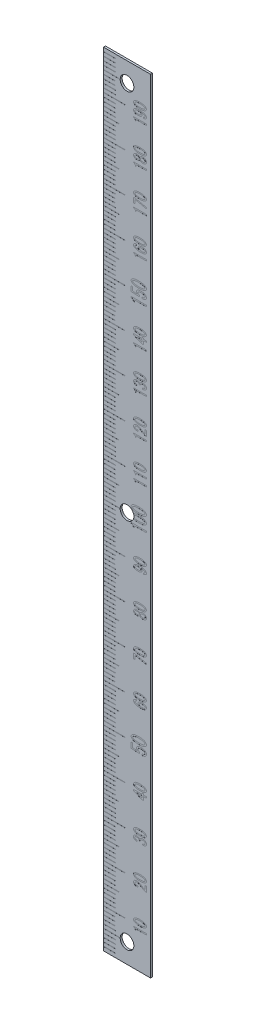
SolidWorks part; units mm, degrees
ref_plane "Front" through (0, 0, 0) normal (0, 0, 1) x (1, 0, 0)
ref_plane "Top" through (0, 0, 0) normal (0, 1, 0) x (1, 0, 0)
ref_plane "Right" through (0, 0, 0) normal (1, 0, 0) x (0, 0, -1)
sketch "Sketch1" plane through (0, 0, 0) normal (0, 0, 1) x (1, 0, 0)
  line L1 (0, 0) -> (0, 200)
  line L2 (0, 0) -> (12, 0)
  line L3 (12, 0) -> (12, 200)
  line L4 (0, 200) -> (12, 200)
  dimension "D1" = 200
  dimension "D2" = 12
extrude "Extrude1" add sketch "Sketch1" along normal blind 0.5
sketch "Sketch2" plane through (0, 0, 0.5) normal (0, 0, 1) x (1, 0, 0)
  line L0 (0, 200) -> (0, 0) construction
  line L1 (0, 0) -> (12, 0) construction
  line L2 (12, 200) -> (0, 200) construction
  circle A0 centre (6, 5) radius 1.75
  circle A1 centre (6, 195) radius 1.75
  circle A4 centre (6, 100) radius 1.75
  dimension "D1" = 6
  dimension "D2" = 6
  dimension "D3" = 5
  dimension "D4" = 5
  dimension "D5" = 3.5
  dimension "D6" = 3.5
  dimension "D8" = 2
extrude "Extrude2" cut sketch "Sketch2" against normal through all and the other way through all
sketch "Sketch3" plane through (0, 0, 0.5) normal (0, 0, 1) x (1, 0, 0)
  line L0 (7.5, 187.4) -> (11, 187.4) construction
  line L1 (7.5, 137.4) -> (11, 137.4) construction
  line L2 (7.5, 137.4) -> (7.5, 140.9) construction
  line L3 (7.5, 140.9) -> (11, 140.9) construction
  line L4 (11, 137.4) -> (11, 140.9) construction
  line L6 (11, 127.4) -> (11, 130.9) construction
  line L7 (11, 117.4) -> (11, 120.9) construction
  line L8 (11, 107.4) -> (11, 110.9) construction
  line L9 (11, 97.2) -> (11, 102.8) construction
  line L10 (11, 88.25) -> (11, 91.75) construction
  line L11 (11, 78.25) -> (11, 81.75) construction
  line L12 (11, 68.25) -> (11, 71.75) construction
  line L13 (11, 58.25) -> (11, 61.75) construction
  line L14 (11, 48) -> (11, 52) construction
  line L15 (11, 38.25) -> (11, 43.5) construction
  line L16 (11, 110) -> (-4.9003, 110) construction
  line L17 (11, 50) -> (-4.9003, 50) construction
  line L18 (11, 28.25) -> (11, 33.5) construction
  line L19 (11, 18.25) -> (11, 23.5) construction
  line L20 (11, 8.25) -> (11, 13.5) construction
  line L21 (11, 100) -> (-4.9003, 100) construction
  line L22 (11, 120) -> (-4.9003, 120) construction
  line L23 (11, 130) -> (-4.9003, 130) construction
  line L24 (11, 140) -> (-4.9003, 140) construction
  line L25 (7.5, 187.4) -> (7.5, 190.9) construction
  line L26 (7.5, 190.9) -> (11, 190.9) construction
  line L27 (11, 187.4) -> (11, 190.9) construction
  line L28 (11, 177.4) -> (11, 180.9) construction
  line L29 (11, 167.4) -> (11, 170.9) construction
  line L30 (11, 157.4) -> (11, 160.9) construction
  line L31 (11, 147.2) -> (11, 152.8) construction
  line L32 (11, 160) -> (-4.9003, 160) construction
  line L33 (11, 150) -> (-4.9003, 150) construction
  line L34 (11, 170) -> (-4.9003, 170) construction
  line L35 (11, 180) -> (-4.9003, 180) construction
  line L36 (11, 190) -> (-4.9003, 190) construction
  line L37 (11, 40) -> (-4.9003, 40) construction
  line L38 (11, 30) -> (-4.9003, 30) construction
  line L39 (11, 20) -> (-4.9003, 20) construction
  line L40 (11, 10) -> (-4.9003, 10) construction
  line L41 (12, 0) -> (12, 200) construction
  text T0 "140" font "ＭＳ ゴシック" height in points 11
  text T1 "130" font "ＭＳ ゴシック" height in points 11
  text T2 "120" font "ＭＳ ゴシック" height in points 11
  text T3 "110" font "ＭＳ ゴシック" height in points 11
  text T4 "100" font "ＭＳ ゴシック" height in points 13
  text T5 "90" font "ＭＳ ゴシック" height in points 11
  text T6 "80" font "ＭＳ ゴシック" height in points 11
  text T7 "70" font "ＭＳ ゴシック" height in points 11
  text T8 "60" font "ＭＳ ゴシック" height in points 11
  text T9 "50" font "ＭＳ ゴシック" height in points 13
  text T10 "40" font "ＭＳ ゴシック" height in points 11
  text T11 "30" font "ＭＳ ゴシック" height in points 11
  text T12 "20" font "ＭＳ ゴシック" height in points 11
  text T13 "10" font "ＭＳ ゴシック" height in points 11
  text T14 "150" font "ＭＳ ゴシック" height in points 13
  text T15 "160" font "ＭＳ ゴシック" height in points 11
  text T16 "170" font "ＭＳ ゴシック" height in points 11
  text T17 "180" font "ＭＳ ゴシック" height in points 11
  text T18 "190" font "ＭＳ ゴシック" height in points 11
  point P19 (11, 100)
  dimension "D1" = 3.5
  dimension "D2" = 2.6
  dimension "D3" = 1
  dimension "D4" = 3.5
  dimension "D8" = 4
  dimension "D9" = 50
  dimension "D10" = 2
  dimension "D11" = 5.6
  dimension "D12" = 2.6
  dimension "D5" = 3.5
  dimension "D13" = 2.6
  dimension "D14" = 2.6
  dimension "D15" = 2
  dimension "D16" = 1.75
  dimension "D17" = 1.75
  dimension "D18" = 1.75
  dimension "D19" = 1.75
  dimension "D6" = 5
  dimension "D7" = 5
extrude "Extrude3" cut sketch "Sketch3" against normal blind 0.01
sketch "Sketch4" plane through (0, 0, 0.5) normal (0, 0, 1) x (1, 0, 0)
  line L5 (12, 200) -> (0, 200) construction
  line L806 (6, 200) -> (6, 0) construction
  line L807 (0, 0) -> (12, 0) construction
  line L808 (3, 1.05) -> (3, 0.95)
  line L809 (0, 0.95) -> (3, 0.95)
  line L810 (0, 1.05) -> (3, 1.05)
  line L811 (0, 1.05) -> (0, 0.95)
  line L812 (3, 2.05) -> (3, 1.95)
  line L813 (0, 1.95) -> (3, 1.95)
  line L814 (0, 2.05) -> (3, 2.05)
  line L815 (0, 2.05) -> (0, 1.95)
  line L816 (3, 3.05) -> (3, 2.95)
  line L817 (0, 2.95) -> (3, 2.95)
  line L818 (0, 3.05) -> (3, 3.05)
  line L819 (0, 3.05) -> (0, 2.95)
  line L820 (3, 4.05) -> (3, 3.95)
  line L821 (0, 3.95) -> (3, 3.95)
  line L822 (0, 4.05) -> (3, 4.05)
  line L823 (0, 4.05) -> (0, 3.95)
  line L824 (3, 6.05) -> (3, 5.95)
  line L825 (0, 5.95) -> (3, 5.95)
  line L826 (0, 6.05) -> (3, 6.05)
  line L827 (0, 6.05) -> (0, 5.95)
  line L828 (3, 7.05) -> (3, 6.95)
  line L829 (0, 6.95) -> (3, 6.95)
  line L830 (0, 7.05) -> (3, 7.05)
  line L831 (0, 7.05) -> (0, 6.95)
  line L832 (3, 8.05) -> (3, 7.95)
  line L833 (0, 7.95) -> (3, 7.95)
  line L834 (0, 8.05) -> (3, 8.05)
  line L835 (3, 9.05) -> (3, 8.95)
  line L836 (0, 8.95) -> (3, 8.95)
  line L837 (0, 9.05) -> (0, 8.95)
  line L838 (0, 9.05) -> (3, 9.05)
  line L839 (4, 4.95) -> (4, 5.05)
  line L840 (0, 5.05) -> (4, 5.05)
  line L841 (0, 4.95) -> (0, 5.05)
  line L842 (0, 4.95) -> (4, 4.95)
  line L843 (0, 8.05) -> (0, 7.95)
  line L844 (0, 9.95) -> (0, 10.05)
  line L845 (5.5, 9.95) -> (0, 9.95)
  line L846 (5.5, 10.05) -> (5.5, 9.95)
  line L847 (0, 10.05) -> (5.5, 10.05)
  line L848 (3, 11.05) -> (3, 10.95)
  line L849 (0, 10.95) -> (3, 10.95)
  line L850 (0, 11.05) -> (3, 11.05)
  line L851 (0, 11.05) -> (0, 10.95)
  line L852 (3, 12.05) -> (3, 11.95)
  line L853 (0, 11.95) -> (3, 11.95)
  line L854 (0, 12.05) -> (3, 12.05)
  line L855 (0, 12.05) -> (0, 11.95)
  line L856 (3, 13.05) -> (3, 12.95)
  line L857 (0, 12.95) -> (3, 12.95)
  line L858 (0, 13.05) -> (3, 13.05)
  line L859 (0, 13.05) -> (0, 12.95)
  line L860 (3, 14.05) -> (3, 13.95)
  line L861 (0, 13.95) -> (3, 13.95)
  line L862 (0, 14.05) -> (3, 14.05)
  line L863 (0, 14.05) -> (0, 13.95)
  line L864 (3, 16.05) -> (3, 15.95)
  line L865 (0, 15.95) -> (3, 15.95)
  line L866 (0, 16.05) -> (3, 16.05)
  line L867 (0, 16.05) -> (0, 15.95)
  line L868 (3, 17.05) -> (3, 16.95)
  line L869 (0, 16.95) -> (3, 16.95)
  line L870 (0, 17.05) -> (3, 17.05)
  line L871 (0, 17.05) -> (0, 16.95)
  line L872 (3, 18.05) -> (3, 17.95)
  line L873 (0, 17.95) -> (3, 17.95)
  line L874 (0, 18.05) -> (3, 18.05)
  line L875 (3, 19.05) -> (3, 18.95)
  line L876 (0, 18.95) -> (3, 18.95)
  line L877 (0, 19.05) -> (0, 18.95)
  line L878 (0, 19.05) -> (3, 19.05)
  line L879 (4, 14.95) -> (4, 15.05)
  line L880 (0, 15.05) -> (4, 15.05)
  line L881 (0, 14.95) -> (0, 15.05)
  line L882 (0, 14.95) -> (4, 14.95)
  line L883 (0, 18.05) -> (0, 17.95)
  line L884 (0, 19.95) -> (0, 20.05)
  line L885 (5.5, 19.95) -> (0, 19.95)
  line L886 (5.5, 20.05) -> (5.5, 19.95)
  line L887 (0, 20.05) -> (5.5, 20.05)
  line L888 (3, 21.05) -> (3, 20.95)
  line L889 (0, 20.95) -> (3, 20.95)
  line L890 (0, 21.05) -> (3, 21.05)
  line L891 (0, 21.05) -> (0, 20.95)
  line L892 (3, 22.05) -> (3, 21.95)
  line L893 (0, 21.95) -> (3, 21.95)
  line L894 (0, 22.05) -> (3, 22.05)
  line L895 (0, 22.05) -> (0, 21.95)
  line L896 (3, 23.05) -> (3, 22.95)
  line L897 (0, 22.95) -> (3, 22.95)
  line L898 (0, 23.05) -> (3, 23.05)
  line L899 (0, 23.05) -> (0, 22.95)
  line L900 (3, 24.05) -> (3, 23.95)
  line L901 (0, 23.95) -> (3, 23.95)
  line L902 (0, 24.05) -> (3, 24.05)
  line L903 (0, 24.05) -> (0, 23.95)
  line L904 (3, 26.05) -> (3, 25.95)
  line L905 (0, 25.95) -> (3, 25.95)
  line L906 (0, 26.05) -> (3, 26.05)
  line L907 (0, 26.05) -> (0, 25.95)
  line L908 (3, 27.05) -> (3, 26.95)
  line L909 (0, 26.95) -> (3, 26.95)
  line L910 (0, 27.05) -> (3, 27.05)
  line L911 (0, 27.05) -> (0, 26.95)
  line L912 (3, 28.05) -> (3, 27.95)
  line L913 (0, 27.95) -> (3, 27.95)
  line L914 (0, 28.05) -> (3, 28.05)
  line L915 (3, 29.05) -> (3, 28.95)
  line L916 (0, 28.95) -> (3, 28.95)
  line L917 (0, 29.05) -> (0, 28.95)
  line L918 (0, 29.05) -> (3, 29.05)
  line L919 (4, 24.95) -> (4, 25.05)
  line L920 (0, 25.05) -> (4, 25.05)
  line L921 (0, 24.95) -> (0, 25.05)
  line L922 (0, 24.95) -> (4, 24.95)
  line L923 (0, 28.05) -> (0, 27.95)
  line L924 (0, 29.95) -> (0, 30.05)
  line L925 (5.5, 29.95) -> (0, 29.95)
  line L926 (5.5, 30.05) -> (5.5, 29.95)
  line L927 (0, 30.05) -> (5.5, 30.05)
  line L928 (3, 31.05) -> (3, 30.95)
  line L929 (0, 30.95) -> (3, 30.95)
  line L930 (0, 31.05) -> (3, 31.05)
  line L931 (0, 31.05) -> (0, 30.95)
  line L932 (3, 32.05) -> (3, 31.95)
  line L933 (0, 31.95) -> (3, 31.95)
  line L934 (0, 32.05) -> (3, 32.05)
  line L935 (0, 32.05) -> (0, 31.95)
  line L936 (3, 33.05) -> (3, 32.95)
  line L937 (0, 32.95) -> (3, 32.95)
  line L938 (0, 33.05) -> (3, 33.05)
  line L939 (0, 33.05) -> (0, 32.95)
  line L940 (3, 34.05) -> (3, 33.95)
  line L941 (0, 33.95) -> (3, 33.95)
  line L942 (0, 34.05) -> (3, 34.05)
  line L943 (0, 34.05) -> (0, 33.95)
  line L944 (3, 36.05) -> (3, 35.95)
  line L945 (0, 35.95) -> (3, 35.95)
  line L946 (0, 36.05) -> (3, 36.05)
  line L947 (0, 36.05) -> (0, 35.95)
  line L948 (3, 37.05) -> (3, 36.95)
  line L949 (0, 36.95) -> (3, 36.95)
  line L950 (0, 37.05) -> (3, 37.05)
  line L951 (0, 37.05) -> (0, 36.95)
  line L952 (3, 38.05) -> (3, 37.95)
  line L953 (0, 37.95) -> (3, 37.95)
  line L954 (0, 38.05) -> (3, 38.05)
  line L955 (3, 39.05) -> (3, 38.95)
  line L956 (0, 38.95) -> (3, 38.95)
  line L957 (0, 39.05) -> (0, 38.95)
  line L958 (0, 39.05) -> (3, 39.05)
  line L959 (4, 34.95) -> (4, 35.05)
  line L960 (0, 35.05) -> (4, 35.05)
  line L961 (0, 34.95) -> (0, 35.05)
  line L962 (0, 34.95) -> (4, 34.95)
  line L963 (0, 38.05) -> (0, 37.95)
  line L964 (0, 39.95) -> (0, 40.05)
  line L965 (5.5, 39.95) -> (0, 39.95)
  line L966 (5.5, 40.05) -> (5.5, 39.95)
  line L967 (0, 40.05) -> (5.5, 40.05)
  line L968 (3, 41.05) -> (3, 40.95)
  line L969 (0, 40.95) -> (3, 40.95)
  line L970 (0, 41.05) -> (3, 41.05)
  line L971 (0, 41.05) -> (0, 40.95)
  line L972 (3, 42.05) -> (3, 41.95)
  line L973 (0, 41.95) -> (3, 41.95)
  line L974 (0, 42.05) -> (3, 42.05)
  line L975 (0, 42.05) -> (0, 41.95)
  line L976 (3, 43.05) -> (3, 42.95)
  line L977 (0, 42.95) -> (3, 42.95)
  line L978 (0, 43.05) -> (3, 43.05)
  line L979 (0, 43.05) -> (0, 42.95)
  line L980 (3, 44.05) -> (3, 43.95)
  line L981 (0, 43.95) -> (3, 43.95)
  line L982 (0, 44.05) -> (3, 44.05)
  line L983 (0, 44.05) -> (0, 43.95)
  line L984 (3, 46.05) -> (3, 45.95)
  line L985 (0, 45.95) -> (3, 45.95)
  line L986 (0, 46.05) -> (3, 46.05)
  line L987 (0, 46.05) -> (0, 45.95)
  line L988 (3, 47.05) -> (3, 46.95)
  line L989 (0, 46.95) -> (3, 46.95)
  line L990 (0, 47.05) -> (3, 47.05)
  line L991 (0, 47.05) -> (0, 46.95)
  line L992 (3, 48.05) -> (3, 47.95)
  line L993 (0, 47.95) -> (3, 47.95)
  line L994 (0, 48.05) -> (3, 48.05)
  line L995 (3, 49.05) -> (3, 48.95)
  line L996 (0, 48.95) -> (3, 48.95)
  line L997 (0, 49.05) -> (0, 48.95)
  line L998 (0, 49.05) -> (3, 49.05)
  line L999 (4, 44.95) -> (4, 45.05)
  line L1000 (0, 45.05) -> (4, 45.05)
  line L1001 (0, 44.95) -> (0, 45.05)
  line L1002 (0, 44.95) -> (4, 44.95)
  line L1003 (0, 48.05) -> (0, 47.95)
  line L1004 (0, 49.95) -> (0, 50.05)
  line L1005 (5.5, 49.95) -> (0, 49.95)
  line L1006 (5.5, 50.05) -> (5.5, 49.95)
  line L1007 (0, 50.05) -> (5.5, 50.05)
  line L1008 (3, 51.05) -> (3, 50.95)
  line L1009 (0, 50.95) -> (3, 50.95)
  line L1010 (0, 51.05) -> (3, 51.05)
  line L1011 (0, 51.05) -> (0, 50.95)
  line L1012 (3, 52.05) -> (3, 51.95)
  line L1013 (0, 51.95) -> (3, 51.95)
  line L1014 (0, 52.05) -> (3, 52.05)
  line L1015 (0, 52.05) -> (0, 51.95)
  line L1016 (3, 53.05) -> (3, 52.95)
  line L1017 (0, 52.95) -> (3, 52.95)
  line L1018 (0, 53.05) -> (3, 53.05)
  line L1019 (0, 53.05) -> (0, 52.95)
  line L1020 (3, 54.05) -> (3, 53.95)
  line L1021 (0, 53.95) -> (3, 53.95)
  line L1022 (0, 54.05) -> (3, 54.05)
  line L1023 (0, 54.05) -> (0, 53.95)
  line L1024 (3, 56.05) -> (3, 55.95)
  line L1025 (0, 55.95) -> (3, 55.95)
  line L1026 (0, 56.05) -> (3, 56.05)
  line L1027 (0, 56.05) -> (0, 55.95)
  line L1028 (3, 57.05) -> (3, 56.95)
  line L1029 (0, 56.95) -> (3, 56.95)
  line L1030 (0, 57.05) -> (3, 57.05)
  line L1031 (0, 57.05) -> (0, 56.95)
  line L1032 (3, 58.05) -> (3, 57.95)
  line L1033 (0, 57.95) -> (3, 57.95)
  line L1034 (0, 58.05) -> (3, 58.05)
  line L1035 (3, 59.05) -> (3, 58.95)
  line L1036 (0, 58.95) -> (3, 58.95)
  line L1037 (0, 59.05) -> (0, 58.95)
  line L1038 (0, 59.05) -> (3, 59.05)
  line L1039 (4, 54.95) -> (4, 55.05)
  line L1040 (0, 55.05) -> (4, 55.05)
  line L1041 (0, 54.95) -> (0, 55.05)
  line L1042 (0, 54.95) -> (4, 54.95)
  line L1043 (0, 58.05) -> (0, 57.95)
  line L1044 (0, 59.95) -> (0, 60.05)
  line L1045 (5.5, 59.95) -> (0, 59.95)
  line L1046 (5.5, 60.05) -> (5.5, 59.95)
  line L1047 (0, 60.05) -> (5.5, 60.05)
  line L1048 (3, 61.05) -> (3, 60.95)
  line L1049 (0, 60.95) -> (3, 60.95)
  line L1050 (0, 61.05) -> (3, 61.05)
  line L1051 (0, 61.05) -> (0, 60.95)
  line L1052 (3, 62.05) -> (3, 61.95)
  line L1053 (0, 61.95) -> (3, 61.95)
  line L1054 (0, 62.05) -> (3, 62.05)
  line L1055 (0, 62.05) -> (0, 61.95)
  line L1056 (3, 63.05) -> (3, 62.95)
  line L1057 (0, 62.95) -> (3, 62.95)
  line L1058 (0, 63.05) -> (3, 63.05)
  line L1059 (0, 63.05) -> (0, 62.95)
  line L1060 (3, 64.05) -> (3, 63.95)
  line L1061 (0, 63.95) -> (3, 63.95)
  line L1062 (0, 64.05) -> (3, 64.05)
  line L1063 (0, 64.05) -> (0, 63.95)
  line L1064 (3, 66.05) -> (3, 65.95)
  line L1065 (0, 65.95) -> (3, 65.95)
  line L1066 (0, 66.05) -> (3, 66.05)
  line L1067 (0, 66.05) -> (0, 65.95)
  line L1068 (3, 67.05) -> (3, 66.95)
  line L1069 (0, 66.95) -> (3, 66.95)
  line L1070 (0, 67.05) -> (3, 67.05)
  line L1071 (0, 67.05) -> (0, 66.95)
  line L1072 (3, 68.05) -> (3, 67.95)
  line L1073 (0, 67.95) -> (3, 67.95)
  line L1074 (0, 68.05) -> (3, 68.05)
  line L1075 (3, 69.05) -> (3, 68.95)
  line L1076 (0, 68.95) -> (3, 68.95)
  line L1077 (0, 69.05) -> (0, 68.95)
  line L1078 (0, 69.05) -> (3, 69.05)
  line L1079 (4, 64.95) -> (4, 65.05)
  line L1080 (0, 65.05) -> (4, 65.05)
  line L1081 (0, 64.95) -> (0, 65.05)
  line L1082 (0, 64.95) -> (4, 64.95)
  line L1083 (0, 68.05) -> (0, 67.95)
  line L1084 (0, 69.95) -> (0, 70.05)
  line L1085 (5.5, 69.95) -> (0, 69.95)
  line L1086 (5.5, 70.05) -> (5.5, 69.95)
  line L1087 (0, 70.05) -> (5.5, 70.05)
  line L1088 (3, 71.05) -> (3, 70.95)
  line L1089 (0, 70.95) -> (3, 70.95)
  line L1090 (0, 71.05) -> (3, 71.05)
  line L1091 (0, 71.05) -> (0, 70.95)
  line L1092 (3, 72.05) -> (3, 71.95)
  line L1093 (0, 71.95) -> (3, 71.95)
  line L1094 (0, 72.05) -> (3, 72.05)
  line L1095 (0, 72.05) -> (0, 71.95)
  line L1096 (3, 73.05) -> (3, 72.95)
  line L1097 (0, 72.95) -> (3, 72.95)
  line L1098 (0, 73.05) -> (3, 73.05)
  line L1099 (0, 73.05) -> (0, 72.95)
  line L1100 (3, 74.05) -> (3, 73.95)
  line L1101 (0, 73.95) -> (3, 73.95)
  line L1102 (0, 74.05) -> (3, 74.05)
  line L1103 (0, 74.05) -> (0, 73.95)
  line L1104 (3, 76.05) -> (3, 75.95)
  line L1105 (0, 75.95) -> (3, 75.95)
  line L1106 (0, 76.05) -> (3, 76.05)
  line L1107 (0, 76.05) -> (0, 75.95)
  line L1108 (3, 77.05) -> (3, 76.95)
  line L1109 (0, 76.95) -> (3, 76.95)
  line L1110 (0, 77.05) -> (3, 77.05)
  line L1111 (0, 77.05) -> (0, 76.95)
  line L1112 (3, 78.05) -> (3, 77.95)
  line L1113 (0, 77.95) -> (3, 77.95)
  line L1114 (0, 78.05) -> (3, 78.05)
  line L1115 (3, 79.05) -> (3, 78.95)
  line L1116 (0, 78.95) -> (3, 78.95)
  line L1117 (0, 79.05) -> (0, 78.95)
  line L1118 (0, 79.05) -> (3, 79.05)
  line L1119 (4, 74.95) -> (4, 75.05)
  line L1120 (0, 75.05) -> (4, 75.05)
  line L1121 (0, 74.95) -> (0, 75.05)
  line L1122 (0, 74.95) -> (4, 74.95)
  line L1123 (0, 78.05) -> (0, 77.95)
  line L1124 (0, 79.95) -> (0, 80.05)
  line L1125 (5.5, 79.95) -> (0, 79.95)
  line L1126 (5.5, 80.05) -> (5.5, 79.95)
  line L1127 (0, 80.05) -> (5.5, 80.05)
  line L1128 (3, 81.05) -> (3, 80.95)
  line L1129 (0, 80.95) -> (3, 80.95)
  line L1130 (0, 81.05) -> (3, 81.05)
  line L1131 (0, 81.05) -> (0, 80.95)
  line L1132 (3, 82.05) -> (3, 81.95)
  line L1133 (0, 81.95) -> (3, 81.95)
  line L1134 (0, 82.05) -> (3, 82.05)
  line L1135 (0, 82.05) -> (0, 81.95)
  line L1136 (3, 83.05) -> (3, 82.95)
  line L1137 (0, 82.95) -> (3, 82.95)
  line L1138 (0, 83.05) -> (3, 83.05)
  line L1139 (0, 83.05) -> (0, 82.95)
  line L1140 (3, 84.05) -> (3, 83.95)
  line L1141 (0, 83.95) -> (3, 83.95)
  line L1142 (0, 84.05) -> (3, 84.05)
  line L1143 (0, 84.05) -> (0, 83.95)
  line L1144 (3, 86.05) -> (3, 85.95)
  line L1145 (0, 85.95) -> (3, 85.95)
  line L1146 (0, 86.05) -> (3, 86.05)
  line L1147 (0, 86.05) -> (0, 85.95)
  line L1148 (3, 87.05) -> (3, 86.95)
  line L1149 (0, 86.95) -> (3, 86.95)
  line L1150 (0, 87.05) -> (3, 87.05)
  line L1151 (0, 87.05) -> (0, 86.95)
  line L1152 (3, 88.05) -> (3, 87.95)
  line L1153 (0, 87.95) -> (3, 87.95)
  line L1154 (0, 88.05) -> (3, 88.05)
  line L1155 (3, 89.05) -> (3, 88.95)
  line L1156 (0, 88.95) -> (3, 88.95)
  line L1157 (0, 89.05) -> (0, 88.95)
  line L1158 (0, 89.05) -> (3, 89.05)
  line L1159 (4, 84.95) -> (4, 85.05)
  line L1160 (0, 85.05) -> (4, 85.05)
  line L1161 (0, 84.95) -> (0, 85.05)
  line L1162 (0, 84.95) -> (4, 84.95)
  line L1163 (0, 88.05) -> (0, 87.95)
  line L1164 (0, 89.95) -> (0, 90.05)
  line L1165 (5.5, 89.95) -> (0, 89.95)
  line L1166 (5.5, 90.05) -> (5.5, 89.95)
  line L1167 (0, 90.05) -> (5.5, 90.05)
  line L1168 (3, 91.05) -> (3, 90.95)
  line L1169 (0, 90.95) -> (3, 90.95)
  line L1170 (0, 91.05) -> (3, 91.05)
  line L1171 (0, 91.05) -> (0, 90.95)
  line L1172 (3, 92.05) -> (3, 91.95)
  line L1173 (0, 91.95) -> (3, 91.95)
  line L1174 (0, 92.05) -> (3, 92.05)
  line L1175 (0, 92.05) -> (0, 91.95)
  line L1176 (3, 93.05) -> (3, 92.95)
  line L1177 (0, 92.95) -> (3, 92.95)
  line L1178 (0, 93.05) -> (3, 93.05)
  line L1179 (0, 93.05) -> (0, 92.95)
  line L1180 (3, 94.05) -> (3, 93.95)
  line L1181 (0, 93.95) -> (3, 93.95)
  line L1182 (0, 94.05) -> (3, 94.05)
  line L1183 (0, 94.05) -> (0, 93.95)
  line L1184 (3, 96.05) -> (3, 95.95)
  line L1185 (0, 95.95) -> (3, 95.95)
  line L1186 (0, 96.05) -> (3, 96.05)
  line L1187 (0, 96.05) -> (0, 95.95)
  line L1188 (3, 97.05) -> (3, 96.95)
  line L1189 (0, 96.95) -> (3, 96.95)
  line L1190 (0, 97.05) -> (3, 97.05)
  line L1191 (0, 97.05) -> (0, 96.95)
  line L1192 (3, 98.05) -> (3, 97.95)
  line L1193 (0, 97.95) -> (3, 97.95)
  line L1194 (0, 98.05) -> (3, 98.05)
  line L1195 (3, 99.05) -> (3, 98.95)
  line L1196 (0, 98.95) -> (3, 98.95)
  line L1197 (0, 99.05) -> (0, 98.95)
  line L1198 (0, 99.05) -> (3, 99.05)
  line L1199 (4, 94.95) -> (4, 95.05)
  line L1200 (0, 95.05) -> (4, 95.05)
  line L1201 (0, 94.95) -> (0, 95.05)
  line L1202 (0, 94.95) -> (4, 94.95)
  line L1203 (0, 98.05) -> (0, 97.95)
  line L1204 (0, 99.95) -> (0, 100.05)
  line L1205 (5.5, 99.95) -> (0, 99.95)
  line L1206 (5.5, 100.05) -> (5.5, 99.95)
  line L1207 (0, 100.05) -> (5.5, 100.05)
  line L1208 (3, 101.05) -> (3, 100.95)
  line L1209 (0, 100.95) -> (3, 100.95)
  line L1210 (0, 101.05) -> (3, 101.05)
  line L1211 (0, 101.05) -> (0, 100.95)
  line L1212 (3, 102.05) -> (3, 101.95)
  line L1213 (0, 101.95) -> (3, 101.95)
  line L1214 (0, 102.05) -> (3, 102.05)
  line L1215 (0, 102.05) -> (0, 101.95)
  line L1216 (3, 103.05) -> (3, 102.95)
  line L1217 (0, 102.95) -> (3, 102.95)
  line L1218 (0, 103.05) -> (3, 103.05)
  line L1219 (0, 103.05) -> (0, 102.95)
  line L1220 (3, 104.05) -> (3, 103.95)
  line L1221 (0, 103.95) -> (3, 103.95)
  line L1222 (0, 104.05) -> (3, 104.05)
  line L1223 (0, 104.05) -> (0, 103.95)
  line L1224 (3, 106.05) -> (3, 105.95)
  line L1225 (0, 105.95) -> (3, 105.95)
  line L1226 (0, 106.05) -> (3, 106.05)
  line L1227 (0, 106.05) -> (0, 105.95)
  line L1228 (3, 107.05) -> (3, 106.95)
  line L1229 (0, 106.95) -> (3, 106.95)
  line L1230 (0, 107.05) -> (3, 107.05)
  line L1231 (0, 107.05) -> (0, 106.95)
  line L1232 (3, 108.05) -> (3, 107.95)
  line L1233 (0, 107.95) -> (3, 107.95)
  line L1234 (0, 108.05) -> (3, 108.05)
  line L1235 (3, 109.05) -> (3, 108.95)
  line L1236 (0, 108.95) -> (3, 108.95)
  line L1237 (0, 109.05) -> (0, 108.95)
  line L1238 (0, 109.05) -> (3, 109.05)
  line L1239 (4, 104.95) -> (4, 105.05)
  line L1240 (0, 105.05) -> (4, 105.05)
  line L1241 (0, 104.95) -> (0, 105.05)
  line L1242 (0, 104.95) -> (4, 104.95)
  line L1243 (0, 108.05) -> (0, 107.95)
  line L1244 (0, 109.95) -> (0, 110.05)
  line L1245 (5.5, 109.95) -> (0, 109.95)
  line L1246 (5.5, 110.05) -> (5.5, 109.95)
  line L1247 (0, 110.05) -> (5.5, 110.05)
  line L1248 (3, 111.05) -> (3, 110.95)
  line L1249 (0, 110.95) -> (3, 110.95)
  line L1250 (0, 111.05) -> (3, 111.05)
  line L1251 (0, 111.05) -> (0, 110.95)
  line L1252 (3, 112.05) -> (3, 111.95)
  line L1253 (0, 111.95) -> (3, 111.95)
  line L1254 (0, 112.05) -> (3, 112.05)
  line L1255 (0, 112.05) -> (0, 111.95)
  line L1256 (3, 113.05) -> (3, 112.95)
  line L1257 (0, 112.95) -> (3, 112.95)
  line L1258 (0, 113.05) -> (3, 113.05)
  line L1259 (0, 113.05) -> (0, 112.95)
  line L1260 (3, 114.05) -> (3, 113.95)
  line L1261 (0, 113.95) -> (3, 113.95)
  line L1262 (0, 114.05) -> (3, 114.05)
  line L1263 (0, 114.05) -> (0, 113.95)
  line L1264 (3, 116.05) -> (3, 115.95)
  line L1265 (0, 115.95) -> (3, 115.95)
  line L1266 (0, 116.05) -> (3, 116.05)
  line L1267 (0, 116.05) -> (0, 115.95)
  line L1268 (3, 117.05) -> (3, 116.95)
  line L1269 (0, 116.95) -> (3, 116.95)
  line L1270 (0, 117.05) -> (3, 117.05)
  line L1271 (0, 117.05) -> (0, 116.95)
  line L1272 (3, 118.05) -> (3, 117.95)
  line L1273 (0, 117.95) -> (3, 117.95)
  line L1274 (0, 118.05) -> (3, 118.05)
  line L1275 (3, 119.05) -> (3, 118.95)
  line L1276 (0, 118.95) -> (3, 118.95)
  line L1277 (0, 119.05) -> (0, 118.95)
  line L1278 (0, 119.05) -> (3, 119.05)
  line L1279 (4, 114.95) -> (4, 115.05)
  line L1280 (0, 115.05) -> (4, 115.05)
  line L1281 (0, 114.95) -> (0, 115.05)
  line L1282 (0, 114.95) -> (4, 114.95)
  line L1283 (0, 118.05) -> (0, 117.95)
  line L1284 (0, 119.95) -> (0, 120.05)
  line L1285 (5.5, 119.95) -> (0, 119.95)
  line L1286 (5.5, 120.05) -> (5.5, 119.95)
  line L1287 (0, 120.05) -> (5.5, 120.05)
  line L1288 (3, 121.05) -> (3, 120.95)
  line L1289 (0, 120.95) -> (3, 120.95)
  line L1290 (0, 121.05) -> (3, 121.05)
  line L1291 (0, 121.05) -> (0, 120.95)
  line L1292 (3, 122.05) -> (3, 121.95)
  line L1293 (0, 121.95) -> (3, 121.95)
  line L1294 (0, 122.05) -> (3, 122.05)
  line L1295 (0, 122.05) -> (0, 121.95)
  line L1296 (3, 123.05) -> (3, 122.95)
  line L1297 (0, 122.95) -> (3, 122.95)
  line L1298 (0, 123.05) -> (3, 123.05)
  line L1299 (0, 123.05) -> (0, 122.95)
  line L1300 (3, 124.05) -> (3, 123.95)
  line L1301 (0, 123.95) -> (3, 123.95)
  line L1302 (0, 124.05) -> (3, 124.05)
  line L1303 (0, 124.05) -> (0, 123.95)
  line L1304 (3, 126.05) -> (3, 125.95)
  line L1305 (0, 125.95) -> (3, 125.95)
  line L1306 (0, 126.05) -> (3, 126.05)
  line L1307 (0, 126.05) -> (0, 125.95)
  line L1308 (3, 127.05) -> (3, 126.95)
  line L1309 (0, 126.95) -> (3, 126.95)
  line L1310 (0, 127.05) -> (3, 127.05)
  line L1311 (0, 127.05) -> (0, 126.95)
  line L1312 (3, 128.05) -> (3, 127.95)
  line L1313 (0, 127.95) -> (3, 127.95)
  line L1314 (0, 128.05) -> (3, 128.05)
  line L1315 (3, 129.05) -> (3, 128.95)
  line L1316 (0, 128.95) -> (3, 128.95)
  line L1317 (0, 129.05) -> (0, 128.95)
  line L1318 (0, 129.05) -> (3, 129.05)
  line L1319 (4, 124.95) -> (4, 125.05)
  line L1320 (0, 125.05) -> (4, 125.05)
  line L1321 (0, 124.95) -> (0, 125.05)
  line L1322 (0, 124.95) -> (4, 124.95)
  line L1323 (0, 128.05) -> (0, 127.95)
  line L1324 (0, 129.95) -> (0, 130.05)
  line L1325 (5.5, 129.95) -> (0, 129.95)
  line L1326 (5.5, 130.05) -> (5.5, 129.95)
  line L1327 (0, 130.05) -> (5.5, 130.05)
  line L1328 (3, 131.05) -> (3, 130.95)
  line L1329 (0, 130.95) -> (3, 130.95)
  line L1330 (0, 131.05) -> (3, 131.05)
  line L1331 (0, 131.05) -> (0, 130.95)
  line L1332 (3, 132.05) -> (3, 131.95)
  line L1333 (0, 131.95) -> (3, 131.95)
  line L1334 (0, 132.05) -> (3, 132.05)
  line L1335 (0, 132.05) -> (0, 131.95)
  line L1336 (3, 133.05) -> (3, 132.95)
  line L1337 (0, 132.95) -> (3, 132.95)
  line L1338 (0, 133.05) -> (3, 133.05)
  line L1339 (0, 133.05) -> (0, 132.95)
  line L1340 (3, 134.05) -> (3, 133.95)
  line L1341 (0, 133.95) -> (3, 133.95)
  line L1342 (0, 134.05) -> (3, 134.05)
  line L1343 (0, 134.05) -> (0, 133.95)
  line L1344 (3, 136.05) -> (3, 135.95)
  line L1345 (0, 135.95) -> (3, 135.95)
  line L1346 (0, 136.05) -> (3, 136.05)
  line L1347 (0, 136.05) -> (0, 135.95)
  line L1348 (3, 137.05) -> (3, 136.95)
  line L1349 (0, 136.95) -> (3, 136.95)
  line L1350 (0, 137.05) -> (3, 137.05)
  line L1351 (0, 137.05) -> (0, 136.95)
  line L1352 (3, 138.05) -> (3, 137.95)
  line L1353 (0, 137.95) -> (3, 137.95)
  line L1354 (0, 138.05) -> (3, 138.05)
  line L1355 (3, 139.05) -> (3, 138.95)
  line L1356 (0, 138.95) -> (3, 138.95)
  line L1357 (0, 139.05) -> (0, 138.95)
  line L1358 (0, 139.05) -> (3, 139.05)
  line L1359 (4, 134.95) -> (4, 135.05)
  line L1360 (0, 135.05) -> (4, 135.05)
  line L1361 (0, 134.95) -> (0, 135.05)
  line L1362 (0, 134.95) -> (4, 134.95)
  line L1363 (0, 138.05) -> (0, 137.95)
  line L1364 (0, 139.95) -> (0, 140.05)
  line L1365 (5.5, 139.95) -> (0, 139.95)
  line L1366 (5.5, 140.05) -> (5.5, 139.95)
  line L1367 (0, 140.05) -> (5.5, 140.05)
  line L1368 (3, 141.05) -> (3, 140.95)
  line L1369 (0, 140.95) -> (3, 140.95)
  line L1370 (0, 141.05) -> (3, 141.05)
  line L1371 (0, 141.05) -> (0, 140.95)
  line L1372 (3, 142.05) -> (3, 141.95)
  line L1373 (0, 141.95) -> (3, 141.95)
  line L1374 (0, 142.05) -> (3, 142.05)
  line L1375 (0, 142.05) -> (0, 141.95)
  line L1376 (3, 143.05) -> (3, 142.95)
  line L1377 (0, 142.95) -> (3, 142.95)
  line L1378 (0, 143.05) -> (3, 143.05)
  line L1379 (0, 143.05) -> (0, 142.95)
  line L1380 (3, 144.05) -> (3, 143.95)
  line L1381 (0, 143.95) -> (3, 143.95)
  line L1382 (0, 144.05) -> (3, 144.05)
  line L1383 (0, 144.05) -> (0, 143.95)
  line L1384 (3, 146.05) -> (3, 145.95)
  line L1385 (0, 145.95) -> (3, 145.95)
  line L1386 (0, 146.05) -> (3, 146.05)
  line L1387 (0, 146.05) -> (0, 145.95)
  line L1388 (3, 147.05) -> (3, 146.95)
  line L1389 (0, 146.95) -> (3, 146.95)
  line L1390 (0, 147.05) -> (3, 147.05)
  line L1391 (0, 147.05) -> (0, 146.95)
  line L1392 (3, 148.05) -> (3, 147.95)
  line L1393 (0, 147.95) -> (3, 147.95)
  line L1394 (0, 148.05) -> (3, 148.05)
  line L1395 (3, 149.05) -> (3, 148.95)
  line L1396 (0, 148.95) -> (3, 148.95)
  line L1397 (0, 149.05) -> (0, 148.95)
  line L1398 (0, 149.05) -> (3, 149.05)
  line L1399 (4, 144.95) -> (4, 145.05)
  line L1400 (0, 145.05) -> (4, 145.05)
  line L1401 (0, 144.95) -> (0, 145.05)
  line L1402 (0, 144.95) -> (4, 144.95)
  line L1403 (0, 148.05) -> (0, 147.95)
  line L1404 (3, 151.05) -> (3, 150.95)
  line L1405 (0, 150.95) -> (3, 150.95)
  line L1406 (0, 151.05) -> (3, 151.05)
  line L1407 (0, 151.05) -> (0, 150.95)
  line L1408 (3, 152.05) -> (3, 151.95)
  line L1409 (0, 151.95) -> (3, 151.95)
  line L1410 (0, 152.05) -> (3, 152.05)
  line L1411 (0, 152.05) -> (0, 151.95)
  line L1412 (3, 153.05) -> (3, 152.95)
  line L1413 (0, 152.95) -> (3, 152.95)
  line L1414 (0, 153.05) -> (3, 153.05)
  line L1415 (0, 153.05) -> (0, 152.95)
  line L1416 (3, 154.05) -> (3, 153.95)
  line L1417 (0, 153.95) -> (3, 153.95)
  line L1418 (0, 154.05) -> (3, 154.05)
  line L1419 (0, 154.05) -> (0, 153.95)
  line L1420 (3, 156.05) -> (3, 155.95)
  line L1421 (0, 155.95) -> (3, 155.95)
  line L1422 (0, 156.05) -> (3, 156.05)
  line L1423 (0, 156.05) -> (0, 155.95)
  line L1424 (3, 157.05) -> (3, 156.95)
  line L1425 (0, 156.95) -> (3, 156.95)
  line L1426 (0, 157.05) -> (3, 157.05)
  line L1427 (0, 157.05) -> (0, 156.95)
  line L1428 (3, 158.05) -> (3, 157.95)
  line L1429 (0, 157.95) -> (3, 157.95)
  line L1430 (0, 158.05) -> (3, 158.05)
  line L1431 (3, 159.05) -> (3, 158.95)
  line L1432 (0, 158.95) -> (3, 158.95)
  line L1433 (0, 159.05) -> (0, 158.95)
  line L1434 (0, 159.05) -> (3, 159.05)
  line L1435 (4, 154.95) -> (4, 155.05)
  line L1436 (0, 155.05) -> (4, 155.05)
  line L1437 (0, 154.95) -> (0, 155.05)
  line L1438 (0, 154.95) -> (4, 154.95)
  line L1439 (0, 158.05) -> (0, 157.95)
  line L1440 (0, 149.95) -> (0, 150.05)
  line L1441 (5.5, 149.95) -> (0, 149.95)
  line L1442 (5.5, 150.05) -> (5.5, 149.95)
  line L1443 (0, 150.05) -> (5.5, 150.05)
  line L1444 (3, 161.05) -> (3, 160.95)
  line L1445 (0, 160.95) -> (3, 160.95)
  line L1446 (0, 161.05) -> (3, 161.05)
  line L1447 (0, 161.05) -> (0, 160.95)
  line L1448 (3, 162.05) -> (3, 161.95)
  line L1449 (0, 161.95) -> (3, 161.95)
  line L1450 (0, 162.05) -> (3, 162.05)
  line L1451 (0, 162.05) -> (0, 161.95)
  line L1452 (3, 163.05) -> (3, 162.95)
  line L1453 (0, 162.95) -> (3, 162.95)
  line L1454 (0, 163.05) -> (3, 163.05)
  line L1455 (0, 163.05) -> (0, 162.95)
  line L1456 (3, 164.05) -> (3, 163.95)
  line L1457 (0, 163.95) -> (3, 163.95)
  line L1458 (0, 164.05) -> (3, 164.05)
  line L1459 (0, 164.05) -> (0, 163.95)
  line L1460 (3, 166.05) -> (3, 165.95)
  line L1461 (0, 165.95) -> (3, 165.95)
  line L1462 (0, 166.05) -> (3, 166.05)
  line L1463 (0, 166.05) -> (0, 165.95)
  line L1464 (3, 167.05) -> (3, 166.95)
  line L1465 (0, 166.95) -> (3, 166.95)
  line L1466 (0, 167.05) -> (3, 167.05)
  line L1467 (0, 167.05) -> (0, 166.95)
  line L1468 (3, 168.05) -> (3, 167.95)
  line L1469 (0, 167.95) -> (3, 167.95)
  line L1470 (0, 168.05) -> (3, 168.05)
  line L1471 (3, 169.05) -> (3, 168.95)
  line L1472 (0, 168.95) -> (3, 168.95)
  line L1473 (0, 169.05) -> (0, 168.95)
  line L1474 (0, 169.05) -> (3, 169.05)
  line L1475 (4, 164.95) -> (4, 165.05)
  line L1476 (0, 165.05) -> (4, 165.05)
  line L1477 (0, 164.95) -> (0, 165.05)
  line L1478 (0, 164.95) -> (4, 164.95)
  line L1479 (0, 168.05) -> (0, 167.95)
  line L1480 (0, 159.95) -> (0, 160.05)
  line L1481 (5.5, 159.95) -> (0, 159.95)
  line L1482 (5.5, 160.05) -> (5.5, 159.95)
  line L1483 (0, 160.05) -> (5.5, 160.05)
  line L1484 (3, 171.05) -> (3, 170.95)
  line L1485 (0, 170.95) -> (3, 170.95)
  line L1486 (0, 171.05) -> (3, 171.05)
  line L1487 (0, 171.05) -> (0, 170.95)
  line L1488 (3, 172.05) -> (3, 171.95)
  line L1489 (0, 171.95) -> (3, 171.95)
  line L1490 (0, 172.05) -> (3, 172.05)
  line L1491 (0, 172.05) -> (0, 171.95)
  line L1492 (3, 173.05) -> (3, 172.95)
  line L1493 (0, 172.95) -> (3, 172.95)
  line L1494 (0, 173.05) -> (3, 173.05)
  line L1495 (0, 173.05) -> (0, 172.95)
  line L1496 (3, 174.05) -> (3, 173.95)
  line L1497 (0, 173.95) -> (3, 173.95)
  line L1498 (0, 174.05) -> (3, 174.05)
  line L1499 (0, 174.05) -> (0, 173.95)
  line L1500 (3, 176.05) -> (3, 175.95)
  line L1501 (0, 175.95) -> (3, 175.95)
  line L1502 (0, 176.05) -> (3, 176.05)
  line L1503 (0, 176.05) -> (0, 175.95)
  line L1504 (3, 177.05) -> (3, 176.95)
  line L1505 (0, 176.95) -> (3, 176.95)
  line L1506 (0, 177.05) -> (3, 177.05)
  line L1507 (0, 177.05) -> (0, 176.95)
  line L1508 (3, 178.05) -> (3, 177.95)
  line L1509 (0, 177.95) -> (3, 177.95)
  line L1510 (0, 178.05) -> (3, 178.05)
  line L1511 (3, 179.05) -> (3, 178.95)
  line L1512 (0, 178.95) -> (3, 178.95)
  line L1513 (0, 179.05) -> (0, 178.95)
  line L1514 (0, 179.05) -> (3, 179.05)
  line L1515 (4, 174.95) -> (4, 175.05)
  line L1516 (0, 175.05) -> (4, 175.05)
  line L1517 (0, 174.95) -> (0, 175.05)
  line L1518 (0, 174.95) -> (4, 174.95)
  line L1519 (0, 178.05) -> (0, 177.95)
  line L1520 (0, 169.95) -> (0, 170.05)
  line L1521 (5.5, 169.95) -> (0, 169.95)
  line L1522 (5.5, 170.05) -> (5.5, 169.95)
  line L1523 (0, 170.05) -> (5.5, 170.05)
  line L1524 (3, 181.05) -> (3, 180.95)
  line L1525 (0, 180.95) -> (3, 180.95)
  line L1526 (0, 181.05) -> (3, 181.05)
  line L1527 (0, 181.05) -> (0, 180.95)
  line L1528 (3, 182.05) -> (3, 181.95)
  line L1529 (0, 181.95) -> (3, 181.95)
  line L1530 (0, 182.05) -> (3, 182.05)
  line L1531 (0, 182.05) -> (0, 181.95)
  line L1532 (3, 183.05) -> (3, 182.95)
  line L1533 (0, 182.95) -> (3, 182.95)
  line L1534 (0, 183.05) -> (3, 183.05)
  line L1535 (0, 183.05) -> (0, 182.95)
  line L1536 (3, 184.05) -> (3, 183.95)
  line L1537 (0, 183.95) -> (3, 183.95)
  line L1538 (0, 184.05) -> (3, 184.05)
  line L1539 (0, 184.05) -> (0, 183.95)
  line L1540 (3, 186.05) -> (3, 185.95)
  line L1541 (0, 185.95) -> (3, 185.95)
  line L1542 (0, 186.05) -> (3, 186.05)
  line L1543 (0, 186.05) -> (0, 185.95)
  line L1544 (3, 187.05) -> (3, 186.95)
  line L1545 (0, 186.95) -> (3, 186.95)
  line L1546 (0, 187.05) -> (3, 187.05)
  line L1547 (0, 187.05) -> (0, 186.95)
  line L1548 (3, 188.05) -> (3, 187.95)
  line L1549 (0, 187.95) -> (3, 187.95)
  line L1550 (0, 188.05) -> (3, 188.05)
  line L1551 (3, 189.05) -> (3, 188.95)
  line L1552 (0, 188.95) -> (3, 188.95)
  line L1553 (0, 189.05) -> (0, 188.95)
  line L1554 (0, 189.05) -> (3, 189.05)
  line L1555 (4, 184.95) -> (4, 185.05)
  line L1556 (0, 185.05) -> (4, 185.05)
  line L1557 (0, 184.95) -> (0, 185.05)
  line L1558 (0, 184.95) -> (4, 184.95)
  line L1559 (0, 188.05) -> (0, 187.95)
  line L1560 (3, 191.05) -> (3, 190.95)
  line L1561 (0, 190.95) -> (3, 190.95)
  line L1562 (0, 191.05) -> (3, 191.05)
  line L1563 (0, 191.05) -> (0, 190.95)
  line L1564 (3, 192.05) -> (3, 191.95)
  line L1565 (0, 191.95) -> (3, 191.95)
  line L1566 (0, 192.05) -> (3, 192.05)
  line L1567 (0, 192.05) -> (0, 191.95)
  line L1568 (3, 193.05) -> (3, 192.95)
  line L1569 (0, 192.95) -> (3, 192.95)
  line L1570 (0, 193.05) -> (3, 193.05)
  line L1571 (0, 193.05) -> (0, 192.95)
  line L1572 (3, 194.05) -> (3, 193.95)
  line L1573 (0, 193.95) -> (3, 193.95)
  line L1574 (0, 194.05) -> (3, 194.05)
  line L1575 (0, 194.05) -> (0, 193.95)
  line L1576 (0, 179.95) -> (0, 180.05)
  line L1577 (5.5, 179.95) -> (0, 179.95)
  line L1578 (5.5, 180.05) -> (5.5, 179.95)
  line L1579 (0, 180.05) -> (5.5, 180.05)
  line L1580 (3, 196.05) -> (3, 195.95)
  line L1581 (0, 195.95) -> (3, 195.95)
  line L1582 (0, 196.05) -> (3, 196.05)
  line L1583 (0, 196.05) -> (0, 195.95)
  line L1584 (3, 197.05) -> (3, 196.95)
  line L1585 (0, 196.95) -> (3, 196.95)
  line L1586 (0, 197.05) -> (3, 197.05)
  line L1587 (0, 197.05) -> (0, 196.95)
  line L1588 (3, 198.05) -> (3, 197.95)
  line L1589 (0, 197.95) -> (3, 197.95)
  line L1590 (0, 198.05) -> (3, 198.05)
  line L1591 (3, 199.05) -> (3, 198.95)
  line L1592 (0, 198.95) -> (3, 198.95)
  line L1593 (0, 199.05) -> (0, 198.95)
  line L1594 (0, 199.05) -> (3, 199.05)
  line L1595 (4, 194.95) -> (4, 195.05)
  line L1596 (0, 195.05) -> (4, 195.05)
  line L1597 (0, 194.95) -> (0, 195.05)
  line L1598 (0, 194.95) -> (4, 194.95)
  line L1599 (0, 198.05) -> (0, 197.95)
  line L1600 (0, 189.95) -> (0, 190.05)
  line L1601 (5.5, 189.95) -> (0, 189.95)
  line L1602 (5.5, 190.05) -> (5.5, 189.95)
  line L1603 (0, 190.05) -> (5.5, 190.05)
extrude "Extrude4" cut sketch "Sketch4" against normal blind 0.01
move or copy body "Body-Move/Copy2" bodies to move or copy 105 copy no translate (-12, 0, 0)
